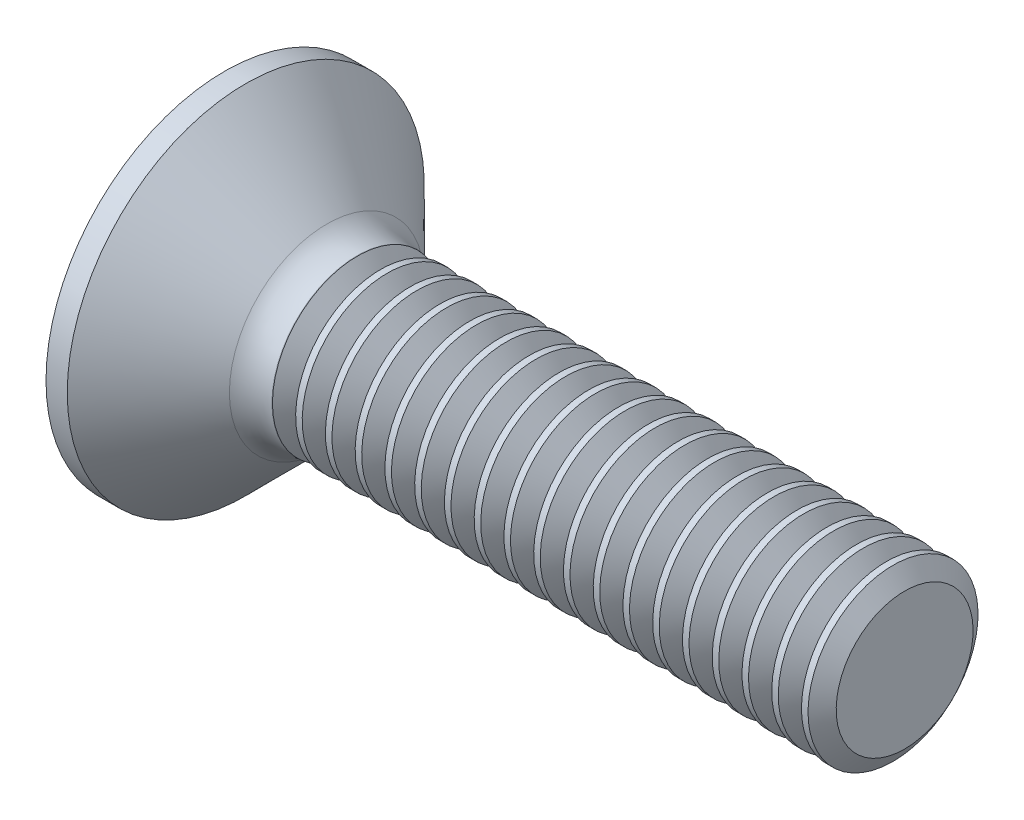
SolidWorks part; units mm, degrees
ref_plane "Plane1" through (0, 0, 0) normal (0, 0, 1) x (1, 0, 0)
ref_plane "Plane2" through (0, 0, 0) normal (0, 1, 0) x (1, 0, 0)
ref_plane "Plane3" through (0, 0, 0) normal (1, 0, 0) x (0, 0, -1)
revolve "Base-Revolve" add sketch "BodySke" angle 360 about L4
sketch "BodySke" plane through (0, 0, 0) normal (0, 0, 1) x (1, 0, 0)
  line L0 (0, 0) -> (17, 0)
  line L1 (17, 0) -> (17, 2)
  line L2 (17, 2) -> (3.7, 2)
  line L3 (1.5, -4.2) -> (3.7, -2) construction
  line L4 (-15.875, 0) -> (82.55, 0) construction
  line L5 (1.5, 4.2) -> (3.7, 2)
  line L6 (4.4, 5.175) -> (4.4, -10.7) construction
  line L7 (1, 2.7793) -> (1, -13.0957) construction
  line L8 (1.5, 4.2) -> (1, 4.2)
  arc A0 (0, 0) -> (1, 4.2) centre (9.32, 0) cw
  dimension "Length" = 16
  dimension "Diameter" = 4
  dimension "Head_dia" = 8.4
  dimension "Head_ang" = 90
  dimension "Advance" = 0.7
  dimension "Thread_nom" = 16
  dimension "Oval_ht" = 1
  dimension "Side_ht" = 2.7
fillet "Fillet1" radius 1 1 edges at (3.7, 0, 2)
sketch "Sketch3" plane through (0, 0, 0) normal (1, 0, 0) x (0, 0, -1)
  line L0 (0.515, -2.5) -> (-0.515, -2.5)
  line L1 (0.515, -2.5) -> (0.515, 2.5)
  line L2 (-0.515, 2.5) -> (0.515, 2.5)
  line L3 (-0.515, 2.5) -> (-0.515, -2.5)
  dimension "D1" = 0.515
  dimension "Cross_width" = 1.03
  dimension "D2" = 2.5
  dimension "Cross_dia" = 5
ref_plane "Plane4" through (3.1, 0, 0) normal (1, 0, 0) x (0, 0, -1)
sketch "Sketch4" plane through (3.1, 0, 0) normal (1, 0, 0) x (0, 0, -1)
  line L0 (0.515, -0.9544) -> (-0.515, -0.9544)
  line L1 (0.515, -0.9544) -> (0.515, 0.9544)
  line L2 (-0.515, 0.9544) -> (0.515, 0.9544)
  line L3 (-0.515, 0.9544) -> (-0.515, -0.9544)
  dimension "D1" = 1.03
  dimension "D2" = 1.9088
  dimension "D3" = 0.515
  dimension "D4" = 0.9544
loft "Recess" cut profiles "Sketch3", "Sketch4"
pattern_circular "RecPat" count 2 every 90 about axis through (0, 0, 0) along (1, 0, 0) of "Recess"
sketch "RecCorSke" plane through (0, 0, 0) normal (0, 0, 1) x (1, 0, 0)
  line L0 (-3.175, 0) -> (15.875, 0) construction
  line L2 (0, 0) -> (0, 1.0678)
  line L3 (0, 1.0678) -> (3.1, 0.851)
  line L4 (3.1, 0.851) -> (3.3765, 0)
  line L5 (3.3765, 0) -> (0, 0)
  dimension "Diameter" = 1.702
  dimension "Depth" = 3.1
  dimension "Draft_angle" = 4
  dimension "Bottom_angle" = 18
revolve "RecessCore" cut sketch "RecCorSke" angle 360 about L0
sketch "ThdSchSke" plane through (0, 0, 0) normal (0, 0, 1) x (1, 0, 0)
  line L0 (4.4, -1.61) -> (4.1269, -2)
  line L1 (4.4, -1.61) -> (4.6731, -2)
  line L2 (4.6731, -2) -> (4.6731, -2.5)
  line L3 (-3.175, 0) -> (5.1513, 0) construction
  line L5 (4.6731, -2.5) -> (4.1269, -2.5)
  line L6 (4.1269, -2.5) -> (4.1269, -2)
  dimension "Thread_minor" = 3.22
  dimension "Diameter" = 4
  dimension "Start" = 4.4
  dimension "SideAngle" = 55
  dimension "VeeAngle" = 70
  dimension "Overcut" = 5
revolve "ThreadSchematic" cut sketch "ThdSchSke" angle 360 about L3
pattern_linear "ThdSchPat" count 19 spacing 0.7 along (1, 0, 0) of "ThreadSchematic"
equation "\"D1@Sketch3\" = \"Cross_width@Sketch3\" / 2"
equation "\"D2@Sketch3\" = \"Cross_dia@Sketch3\" / 2"
equation "\"Depth@RecCorSke\" = \"Cross_depth@Plane4\""
equation "\"D1@Sketch4\" = \"Cross_width@Sketch3\""
equation "\"D2@Sketch4\" = \"Cross_dia@Sketch3\" - 2.0 * \"Cross_depth@Plane4\" * tan(26.5  * 0.017453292)"
equation "\"D3@Sketch4\" = \"D1@Sketch4\" / 2"
equation "\"D4@Sketch4\" = \"D2@Sketch4\" / 2"
equation "\"Thread_length@ThreadCosmetic\" = ((sgn( (\"Length@BodySke\" - \"Advance@BodySke\" - \"Side_ht@BodySke\" ) - \"Thread_nom@BodySke\" )-1)*( (\"Length@BodySke\" - \"Advance@BodySke\" - \"Side_ht@BodySke\" ) - \"Thread_"
equation "\"Thread_minor@ThdSchSke\" = \"Thread_minor@ThreadCosmetic\""
equation "\"Diameter@ThdSchSke\" = \"Diameter@BodySke\""
equation "\"Overcut@ThdSchSke\" = \"Diameter@BodySke\" * 1.25"
equation "\"Start@ThdSchSke\" = \"Oval_ht@BodySke\" + \"Length@BodySke\" - \"Thread_length@ThreadCosmetic\"  '---Countersunk---"
equation "\"Num_threads@ThdSchPat\" = int( \"Thread_length@ThreadCosmetic\" / \"Advance@BodySke\" + 0.999 )  + 1"
equation "\"Advance@ThdSchPat\" = \"Thread_length@ThreadCosmetic\" /  (\"Num_threads@ThdSchPat\" - 1) 'relax it"
